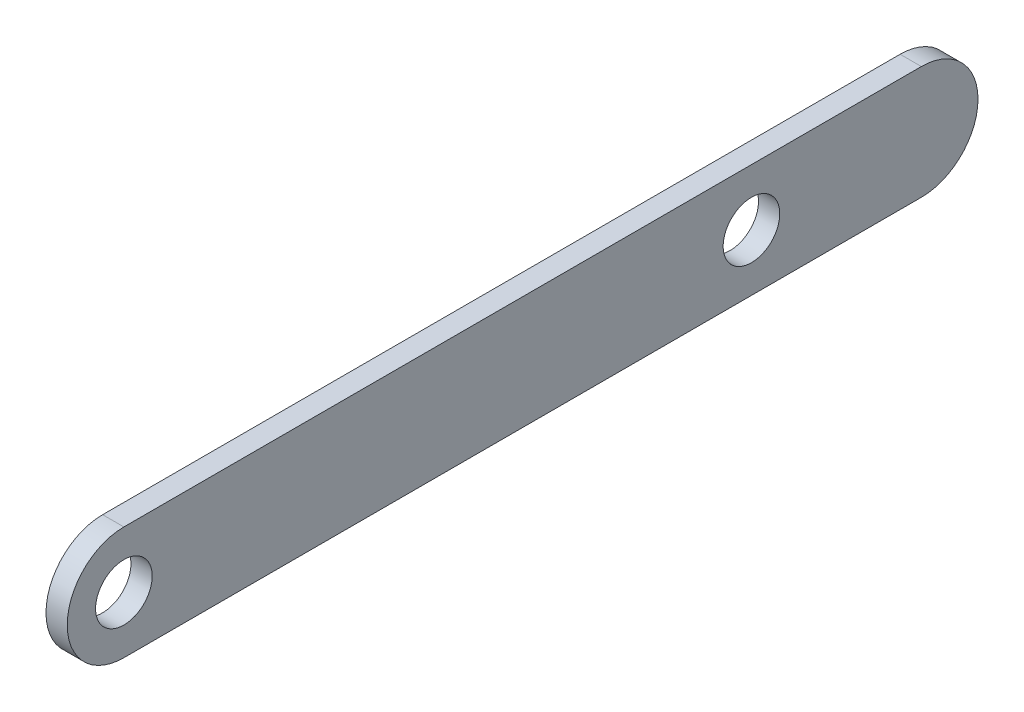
SolidWorks part; units mm, degrees
ref_plane "Front Plane" through (0, 0, 0) normal (0, 0, 1) x (1, 0, 0)
ref_plane "Top Plane" through (0, 0, 0) normal (0, 1, 0) x (1, 0, 0)
ref_plane "Right Plane" through (0, 0, 0) normal (1, 0, 0) x (0, 0, -1)
sketch "Sketch1" plane through (0, 0, 0) normal (1, 0, 0) x (0, 0, -1)
  line L0 (-70.358, 0) -> (70.358, 0) construction
  line L1 (-70.358, 12.7) -> (70.358, 12.7)
  line L2 (-70.358, -12.7) -> (70.358, -12.7)
  line L3 (70.358, 12.7) -> (108.458, 12.7)
  line L7 (108.458, -12.7) -> (70.358, -12.7)
  arc A0 (-70.358, 12.7) -> (-70.358, -12.7) centre (-70.358, 0) ccw
  arc A1 (70.358, -12.7) -> (70.358, 12.7) centre (70.358, 0) ccw construction
  circle A2 centre (70.358, 0) radius 6.35
  circle A3 centre (-70.358, 0) radius 6.35
  arc A6 (108.458, 12.7) -> (108.458, -12.7) centre (108.458, 0) cw
  point P3 (0, 0)
  point P13 (0, 0)
  point P15 (0, 0)
  point P17 (0, 0)
  point P18 (0, 0)
  dimension "D1" = 12.7
  dimension "D4" = 38.1
  dimension "D2" = 25.4
  dimension "D3" = 140.716
extrude "Boss-Extrude1" add sketch "Sketch1" along normal blind 4.7625
